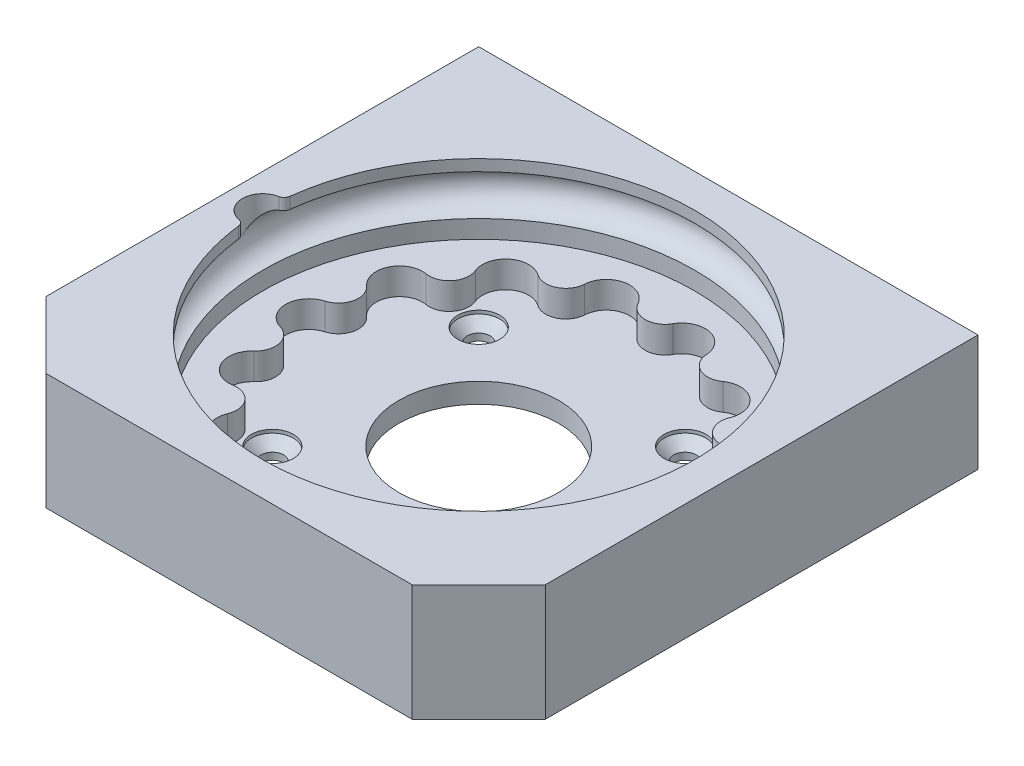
SolidWorks part; units mm, degrees
ref_plane "Front Plane" through (0, 0, 0) normal (0, 0, 1) x (1, 0, 0)
ref_plane "Top Plane" through (0, 0, 0) normal (0, 1, 0) x (1, 0, 0)
ref_plane "Right Plane" through (0, 0, 0) normal (1, 0, 0) x (0, 0, -1)
sketch "Sketch1" plane through (0, 0, 0) normal (0, 1, 0) x (1, 0, 0)
  line L0 (0, 0) -> (7.6226, 33.3969) construction
  line L1 (-37.5, -37.5) -> (37.5, -37.5)
  line L2 (-37.5, -37.5) -> (-37.5, 37.5)
  line L3 (-37.5, 37.5) -> (37.5, 37.5)
  line L4 (37.5, -37.5) -> (37.5, 37.5)
  line L5 (-37.5, -37.5) -> (37.5, 37.5) construction
  line L6 (-37.5, 37.5) -> (37.5, -37.5) construction
  circle A0 centre (0, 0) radius 28 construction
  circle A1 centre (0, 28) radius 3
  circle A2 centre (12.1487, 25.2271) radius 3
  circle A3 centre (21.8913, 17.4577) radius 3
  circle A4 centre (27.298, 6.2306) radius 3
  circle A5 centre (27.298, -6.2306) radius 3
  circle A6 centre (21.8913, -17.4577) radius 3
  circle A7 centre (12.1487, -25.2271) radius 3
  circle A8 centre (0, -28) radius 3
  circle A9 centre (-12.1487, -25.2271) radius 3
  circle A10 centre (-21.8913, -17.4577) radius 3
  circle A11 centre (-27.298, -6.2306) radius 3
  circle A12 centre (-27.298, 6.2306) radius 3
  circle A13 centre (-21.8913, 17.4577) radius 3
  circle A15 centre (-12.1487, 25.2271) radius 3
  arc A16 (2.625, 26.5477) -> (9.1535, 25.0576) centre (5.6743, 24.8607) cw
  arc A17 (13.8837, 22.7797) -> (19.1191, 18.6045) centre (15.899, 19.9367) cw
  arc A18 (22.3925, 14.4999) -> (25.298, 8.4666) centre (22.9747, 11.064) cw
  arc A19 (26.4662, 3.3482) -> (26.4662, -3.3482) centre (25.5, 0) cw
  arc A20 (25.298, -8.4666) -> (22.3925, -14.4999) centre (22.9747, -11.064) cw
  arc A21 (19.1191, -18.6045) -> (13.8837, -22.7797) centre (15.899, -19.9367) cw
  arc A22 (9.1535, -25.0576) -> (2.625, -26.5477) centre (5.6743, -24.8607) cw
  arc A23 (-2.625, -26.5477) -> (-9.1535, -25.0576) centre (-5.6743, -24.8607) cw
  arc A24 (-13.8837, -22.7797) -> (-19.1191, -18.6045) centre (-15.899, -19.9367) cw
  arc A25 (-22.3925, -14.4999) -> (-25.298, -8.4666) centre (-22.9747, -11.064) cw
  arc A26 (-26.4662, -3.3482) -> (-26.4662, 3.3482) centre (-25.5, 0) cw
  arc A27 (-25.298, 8.4666) -> (-22.3925, 14.4999) centre (-22.9747, 11.064) cw
  arc A28 (-19.1191, 18.6045) -> (-13.8837, 22.7797) centre (-15.899, 19.9367) cw
  arc A29 (-9.1535, 25.0576) -> (-2.625, 26.5477) centre (-5.6743, 24.8607) cw
  circle A30 centre (0, 0) radius 4.1
  circle A31 centre (0, 0) radius 25.5 construction
  point P0 (0, 0)
  point P46 (6.4497, 28.2581)
sketch "Sketch3" plane through (0, 0, 0) normal (0, 1, 0) x (1, 0, 0)
  line L1 (-37.5, -37.5) -> (37.5, -37.5)
  line L2 (-37.5, -37.5) -> (-37.5, 37.5)
  line L3 (-37.5, 37.5) -> (37.5, 37.5)
  line L4 (37.5, -37.5) -> (37.5, 37.5)
  line L5 (-37.5, -37.5) -> (37.5, 37.5) construction
  line L6 (-37.5, 37.5) -> (37.5, -37.5) construction
  circle A0 centre (0, 0) radius 4.1 construction
  circle A1 centre (0, 0) radius 4.1
  point P0 (0, 0)
extrude "Boss-Extrude1" add sketch "Sketch3" along normal blind 3
sketch "Sketch4" plane through (0, 3, 0) normal (0, 1, 0) x (1, 0, 0)
  line L4 (37.5, -37.5) -> (37.5, 37.5)
  line L5 (37.5, 37.5) -> (-37.5, 37.5)
  line L6 (-37.5, 37.5) -> (-37.5, -37.5)
  line L7 (-37.5, -37.5) -> (37.5, -37.5)
  line L8 (37.5, -37.5) -> (37.5, 37.5)
  line L9 (37.5, 37.5) -> (-37.5, 37.5)
  line L10 (-37.5, 37.5) -> (-37.5, -37.5)
  line L11 (-37.5, -37.5) -> (37.5, -37.5)
  line L12 (-37.5, -37.5) -> (37.5, -37.5)
  line L13 (37.5, -37.5) -> (37.5, 37.5)
  line L14 (37.5, 37.5) -> (-37.5, 37.5)
  line L15 (-37.5, 37.5) -> (-37.5, -37.5)
  line L16 (-37.5, -37.5) -> (37.5, -37.5)
  line L17 (37.5, -37.5) -> (37.5, 37.5)
  line L18 (37.5, 37.5) -> (-37.5, 37.5)
  line L19 (-37.5, 37.5) -> (-37.5, -37.5)
  arc A0 (26.4662, -3.3482) -> (26.4662, 3.3482) centre (25.5, 0) ccw construction
  circle A1 centre (27.298, -6.2306) radius 3
  circle A2 centre (27.298, -6.2306) radius 3
  circle A3 centre (12.1487, 25.2271) radius 3
  circle A4 centre (12.1487, 25.2271) radius 3
  circle A5 centre (0, 28) radius 3
  circle A6 centre (0, 28) radius 3
  circle A7 centre (-27.298, 6.2306) radius 3
  circle A8 centre (-27.298, 6.2306) radius 3
  circle A9 centre (-27.298, -6.2306) radius 3
  circle A10 centre (-27.298, -6.2306) radius 3
  circle A11 centre (-21.8913, -17.4577) radius 3
  circle A12 centre (-21.8913, -17.4577) radius 3
  circle A13 centre (-12.1487, -25.2271) radius 3
  circle A14 centre (-12.1487, -25.2271) radius 3
  circle A15 centre (0, -28) radius 3
  circle A16 centre (0, -28) radius 3
  circle A17 centre (12.1487, -25.2271) radius 3
  circle A18 centre (12.1487, -25.2271) radius 3
  circle A19 centre (21.8913, -17.4577) radius 3
  circle A20 centre (21.8913, -17.4577) radius 3
  circle A21 centre (27.298, 6.2306) radius 3
  circle A22 centre (27.298, 6.2306) radius 3
  circle A23 centre (21.8913, 17.4577) radius 3
  circle A24 centre (21.8913, 17.4577) radius 3
  circle A25 centre (0, 0) radius 4.1
  circle A26 centre (0, 0) radius 4.1
  circle A27 centre (-12.1487, 25.2271) radius 3
  circle A28 centre (-12.1487, 25.2271) radius 3
  circle A29 centre (-21.8913, 17.4577) radius 3
  circle A30 centre (-21.8913, 17.4577) radius 3
  arc A31 (25.298, 8.4666) -> (22.3925, 14.4999) centre (22.9747, 11.064) ccw construction
  arc A32 (19.1191, 18.6045) -> (13.8837, 22.7797) centre (15.899, 19.9367) ccw construction
  arc A33 (9.1535, 25.0576) -> (2.625, 26.5477) centre (5.6743, 24.8607) ccw construction
  arc A34 (-19.1191, -18.6045) -> (-13.8837, -22.7797) centre (-15.899, -19.9367) ccw construction
  arc A35 (-9.1535, -25.0576) -> (-2.625, -26.5477) centre (-5.6743, -24.8607) ccw construction
  arc A36 (2.625, -26.5477) -> (9.1535, -25.0576) centre (5.6743, -24.8607) ccw construction
  arc A37 (13.8837, -22.7797) -> (19.1191, -18.6045) centre (15.899, -19.9367) ccw construction
  arc A38 (22.3925, -14.4999) -> (25.298, -8.4666) centre (22.9747, -11.064) ccw construction
  arc A39 (-2.625, 26.5477) -> (-9.1535, 25.0576) centre (-5.6743, 24.8607) ccw construction
  arc A40 (-13.8837, 22.7797) -> (-19.1191, 18.6045) centre (-15.899, 19.9367) ccw construction
  arc A41 (-22.3925, 14.4999) -> (-25.298, 8.4666) centre (-22.9747, 11.064) ccw construction
  arc A42 (-26.4662, 3.3482) -> (-26.4662, -3.3482) centre (-25.5, 0) ccw construction
  arc A43 (-25.298, -8.4666) -> (-22.3925, -14.4999) centre (-22.9747, -11.064) ccw construction
  arc A44 (26.4662, -3.3482) -> (26.4662, 3.3482) centre (25.5, 0) ccw
  arc A45 (25.298, 8.4666) -> (22.3925, 14.4999) centre (22.9747, 11.064) ccw
  arc A46 (19.1191, 18.6045) -> (13.8837, 22.7797) centre (15.899, 19.9367) ccw
  arc A47 (9.1535, 25.0576) -> (2.625, 26.5477) centre (5.6743, 24.8607) ccw
  arc A48 (-19.1191, -18.6045) -> (-13.8837, -22.7797) centre (-15.899, -19.9367) ccw
  arc A49 (-9.1535, -25.0576) -> (-2.625, -26.5477) centre (-5.6743, -24.8607) ccw
  arc A50 (2.625, -26.5477) -> (9.1535, -25.0576) centre (5.6743, -24.8607) ccw
  arc A51 (13.8837, -22.7797) -> (19.1191, -18.6045) centre (15.899, -19.9367) ccw
  arc A52 (22.3925, -14.4999) -> (25.298, -8.4666) centre (22.9747, -11.064) ccw
  arc A53 (-2.625, 26.5477) -> (-9.1535, 25.0576) centre (-5.6743, 24.8607) ccw
  arc A54 (-13.8837, 22.7797) -> (-19.1191, 18.6045) centre (-15.899, 19.9367) ccw
  arc A55 (-22.3925, 14.4999) -> (-25.298, 8.4666) centre (-22.9747, 11.064) ccw
  arc A56 (-26.4662, 3.3482) -> (-26.4662, -3.3482) centre (-25.5, 0) ccw
  arc A57 (-25.298, -8.4666) -> (-22.3925, -14.4999) centre (-22.9747, -11.064) ccw
  dimension "D1" = 0
  dimension "D2" = 0
  dimension "D3" = 0
  dimension "D4" = 0
  dimension "D5" = 0
  dimension "D6" = 0
  dimension "D7" = 0
  dimension "D8" = 0
  dimension "D9" = 0
  dimension "D10" = 0
  dimension "D11" = 0
  dimension "D12" = 0
  dimension "D13" = 0
  dimension "D14" = 0
  dimension "D15" = 0
  dimension "D16" = 0
  dimension "D17" = 0
extrude "Boss-Extrude2" add sketch "Sketch4" along normal blind 4 contours A57 A10 A56 A8 A55 A30 A54 A28 A53 A6 A47 A4 A46 A24 A45 A22 A44 A2 A52 A20 A51 A18 A50 A16 A49 A14 A48 A12 M27 M24 M25 M26 | A24 | A22 | A2 | A20 | A18 | A16 | A14 | A12 | A10 | A8 | A30 | A28 | A6 | A4
sketch "Sketch5" plane through (0, 7, 0) normal (0, 1, 0) x (1, 0, 0)
  line L4 (-37.5, -37.5) -> (37.5, -37.5)
  line L5 (37.5, -37.5) -> (37.5, 37.5)
  line L6 (37.5, 37.5) -> (-37.5, 37.5)
  line L7 (-37.5, 37.5) -> (-37.5, -37.5)
  line L8 (-37.5, -37.5) -> (37.5, -37.5)
  line L9 (37.5, -37.5) -> (37.5, 37.5)
  line L10 (37.5, 37.5) -> (-37.5, 37.5)
  line L11 (-37.5, 37.5) -> (-37.5, -37.5)
  circle A0 centre (0, 0) radius 32.45
  circle A1 centre (-32.45, 0) radius 3.05 construction
  circle A2 centre (0, 0) radius 29.4 construction
  dimension "D2" = 64.9
  dimension "D3" = 6.1
  dimension "D4" = 2
  dimension "D1" = 0
extrude "Boss-Extrude3" add sketch "Sketch5" along normal blind 10.5
sketch "Sketch7" plane through (0, 3, 0) normal (0, 1, 0) x (1, 0, 0)
  line L1 (-12.0018, -12.0018) -> (12.0018, -12.0018) construction
  line L2 (-12.0018, -12.0018) -> (-12.0018, 12.0018) construction
  line L3 (-12.0018, 12.0018) -> (12.0018, 12.0018) construction
  line L4 (12.0018, -12.0018) -> (12.0018, 12.0018) construction
  line L5 (-12.0018, -12.0018) -> (12.0018, 12.0018) construction
  line L6 (-12.0018, 12.0018) -> (12.0018, -12.0018) construction
  point P0 (0, 0)
sketch "Sketch8" plane through (0, 17.5, 0) normal (0, 1, 0) x (1, 0, 0)
  line L0 (37.5, 15.533) -> (15.533, 37.5)
  line L1 (-15.533, 37.5) -> (-37.5, 15.533)
  line L2 (-37.5, 15.533) -> (-37.5, -15.533)
  line L3 (-37.5, -15.533) -> (-15.533, -37.5)
  line L4 (-15.533, -37.5) -> (15.533, -37.5)
  line L5 (15.533, -37.5) -> (37.5, -15.533)
  line L6 (37.5, -15.533) -> (37.5, 15.533)
  line L7 (15.533, 37.5) -> (-15.533, 37.5)
  line L8 (-37.5, 37.5) -> (-37.5, -37.5) construction
  circle A0 centre (0, 0) radius 37.5 construction
extrude "Cut-Extrude1" [suppressed] cut sketch "Sketch8" against normal through all flip side to cut
chamfer "Chamfer1" distance 10 angle 45 2 edges at (37.5, 8.75, 37.5) (-37.5, 8.75, 37.5)
sketch "Sketch11" plane through (0, 0, 0) normal (0, 0, 1) x (1, 0, 0)
  line L0 (-32.45, 17.5) -> (-32.45, 7) construction
  line L1 (32.45, 17.5) -> (-32.45, 17.5) construction
  line L4 (0, 0) -> (0, 37.5091) construction
  circle A0 centre (-32.45, 12.75) radius 3.05
  point P0 (0, 0)
  dimension "D1" = 6.1
  dimension "D2" = 4.75
revolve "Cut-Revolve1" cut sketch "Sketch11" angle 360 about L4
sketch "Sketch12" plane through (0, 17.5, 0) normal (0, 1, 0) x (1, 0, 0)
  line L0 (-32.45, 0) -> (0, 0) construction
  circle A0 centre (-32.45, 0) radius 3.05
  circle A1 centre (0, 0) radius 32.45 construction
  circle A2 centre (0, 0) radius 32.45 construction
  dimension "D1" = 6.1
extrude "Cut-Extrude2" cut sketch "Sketch12" against normal up to surface (1.7034 mm away)
fillet "Fillet2" radius 1 2 edges at (-32.3067, 16.65, -3.0466) (-32.3067, 16.65, 3.0466)
sketch "Sketch14" plane through (0, 0, 0) normal (0, -1, 0) x (1, 0, 0)
  line L1 (-15.5, -15.5) -> (15.5, -15.5) construction
  line L2 (-15.5, -15.5) -> (-15.5, 15.5) construction
  line L3 (-15.5, 15.5) -> (15.5, 15.5) construction
  line L4 (15.5, -15.5) -> (15.5, 15.5) construction
  line L5 (-15.5, -15.5) -> (15.5, 15.5) construction
  line L6 (-15.5, 15.5) -> (15.5, -15.5) construction
  circle A0 centre (0, 0) radius 12
  circle A1 centre (-15.5, 15.5) radius 3.3155 construction
  circle A2 centre (15.5, 15.5) radius 2.5111 construction
  circle A3 centre (15.5, -15.5) radius 2.6783 construction
  circle A4 centre (-15.5, -15.5) radius 2.6959 construction
  dimension "D2" = 24
  dimension "D1" = 31
extrude "Cut-Extrude3" cut sketch "Sketch14" against normal through all
hole_wizard "CSK for M3 Countersunk Flat Head Screw1" positions "Sketch15" profile "Sketch16" countersink size "M3" standard "ISO"
sketch "Sketch15" plane through (0, 3, 0) normal (0, 1, 0) x (1, 0, 0)
  point P0 (-15.5, 15.5)
  point P3 (15.5, 15.5)
  point P6 (15.5, -15.5)
  point P9 (-15.5, -15.5)
sketch "Sketch16" plane through (-15.5, 3, -15.5) normal (1, 0, 0) x (0, 0, 1)
  line L0 (0, 0) -> (0, 3)
  line L1 (0, 3) -> (1.7, 3)
  line L2 (1.7, 3) -> (1.7, 1.95)
  line L3 (1.7, 1.95) -> (3.15, 0.5)
  line L4 (3.15, 0.5) -> (3.15, 0)
  line L6 (3.15, 0) -> (0, 0)
  line L7 (-1.7, 1.95) -> (-3.15, 0.5) construction
  line L11 (0, -6.35) -> (0, 107.95) construction
  dimension "Thru Hole Dia." = 3.4
  dimension "Thru Hole Depth" = 3
  dimension "C'Sink Dia." = 6.3
  dimension "C'Sink Angle" = 90
  dimension "Head Clearance" = 0.5
equation "\"N\"= 14"
equation "\"Rr\"= 3"
equation "\"R\"= 28"
equation "\"E\"= 1.5"
equation "\"D3@Sketch1\"=\"N\""
